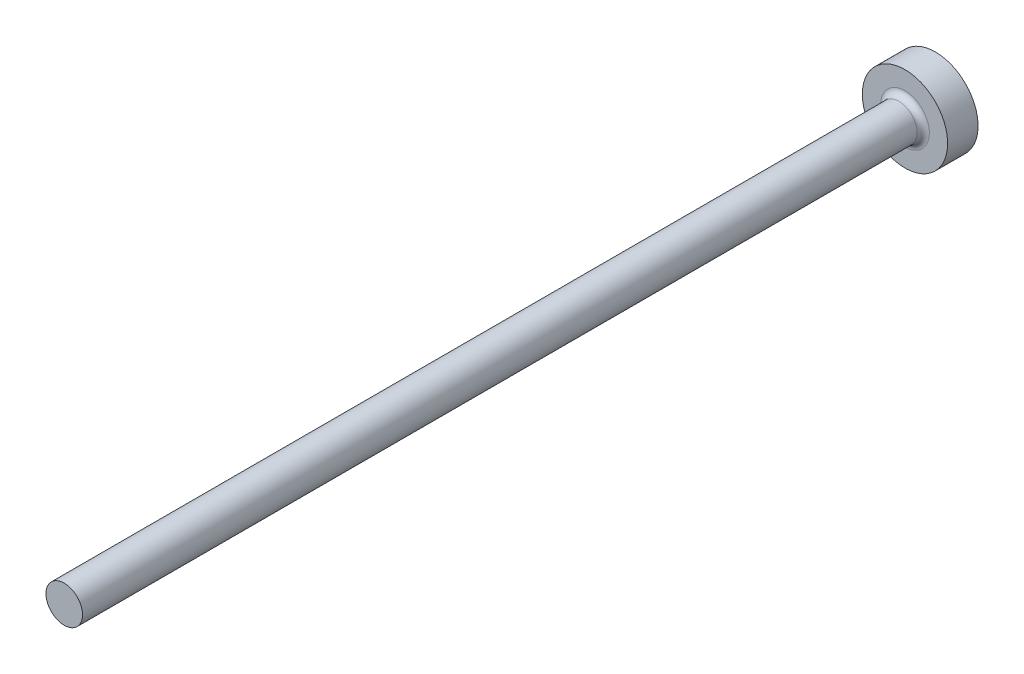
SolidWorks part; units mm, degrees
ref_plane "Plan de face" through (0, 0, 0) normal (0, 0, 1) x (1, 0, 0)
ref_plane "Plan de dessus" through (0, 0, 0) normal (0, 1, 0) x (1, 0, 0)
ref_plane "Plan de droite" through (0, 0, 0) normal (1, 0, 0) x (0, 0, -1)
imported_body "Importée1"
sketch "Esquisse1" plane through (0, 0, 0.0004) normal (0, 0, 1) x (1, 0, 0)
  circle A0 centre (-38.25, 50.745) radius 3
  circle A1 centre (-38.25, 50.745) radius 4 construction
  circle A2 centre (-38.25, 50.745) radius 4
  dimension "D1" = 6
extrude "Extrusion1" cut sketch "Esquisse1" against normal up to surface (138.0004 mm away)
sketch "Esquisse2" plane through (0, 0, -138) normal (0, 0, 1) x (1, 0, 0)
  circle A0 centre (-38.25, 50.745) radius 4.5 construction
  circle A1 centre (-38.25, 50.745) radius 4.5
  circle A2 centre (-38.25, 50.745) radius 4 construction
  circle A3 centre (-38.25, 50.745) radius 4
extrude "Extrusion2" cut sketch "Esquisse2" along normal blind 1
fillet "Congé1" radius 1 1 edges at (-41.25, 50.745, -138)
